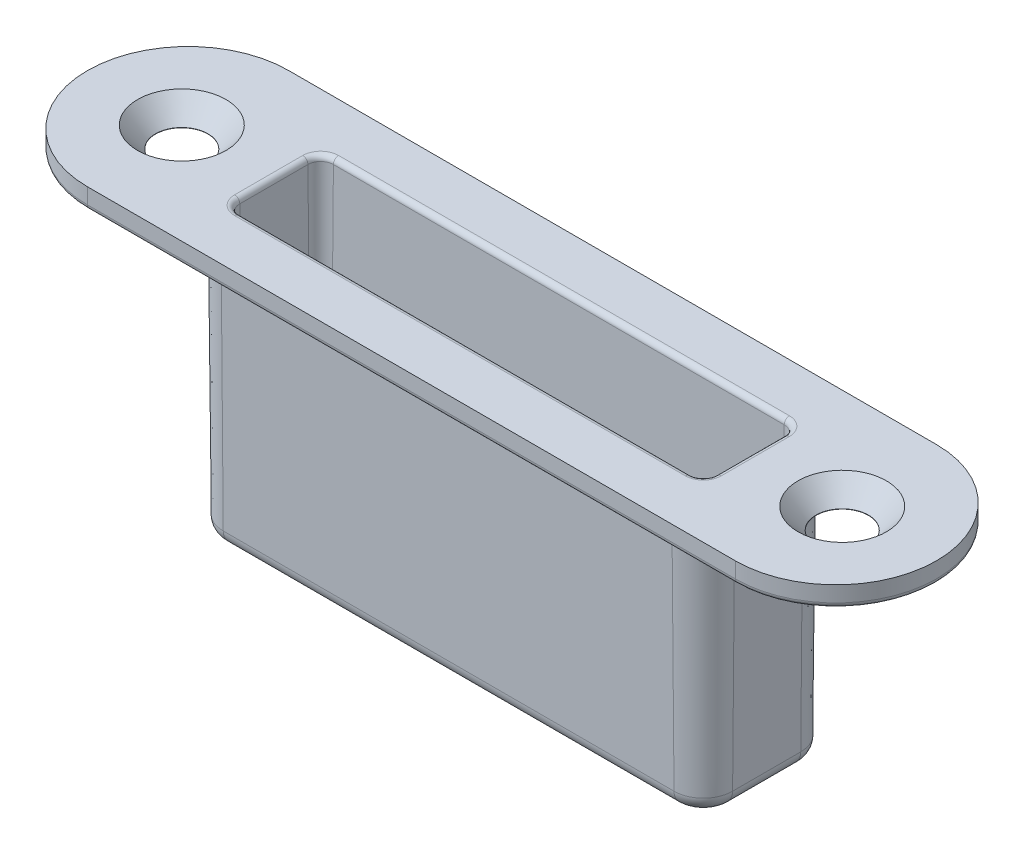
SolidWorks part; units mm, degrees
ref_plane "Front" through (0, 0, 0) normal (0, 0, 1) x (1, 0, 0)
ref_plane "Top" through (0, 0, 0) normal (0, 1, 0) x (1, 0, 0)
ref_plane "Right" through (0, 0, 0) normal (1, 0, 0) x (0, 0, -1)
sketch "Sketch1" plane through (0, 0, 0) normal (0, 1, 0) x (1, 0, 0)
  line L0 (-89.0227, 0) -> (77.7946, 0) construction
  line L1 (30.9, 9.6) -> (-30.9, 9.6)
  line L2 (-30.9, -9.6) -> (30.9, -9.6)
  line L3 (0, 45.3935) -> (0, -48.9224) construction
  line L4 (89.0227, 0) -> (-77.7946, 0) construction
  arc A0 (-30.9, 9.6) -> (-30.9, -9.6) centre (-30.9, 0) ccw
  arc A1 (30.9, 9.6) -> (30.9, -9.6) centre (30.9, 0) cw
  point P9 (0, 9.6)
  point P15 (0, -9.6)
  dimension "D1" = 9.6
  dimension "D2" = 61.8
extrude "Extrude1" add sketch "Sketch1" against normal blind 2
sketch "Sketch2" plane through (0, 0, 0) normal (0, 1, 0) x (-1, 0, 0)
  line L0 (-31.8747, 0) -> (31.774, 0) construction
  line L1 (18.25, 6.25) -> (-18.25, 6.25)
  line L2 (-18.25, -6.25) -> (18.25, -6.25)
  line L3 (0, -14.4297) -> (0, 13.9947) construction
  line L4 (24.5, 0) -> (24.5, -3.25)
  line L5 (21.5, -6.25) -> (18.25, -6.25)
  line L6 (24.5, 0) -> (24.5, 3.25)
  line L7 (21.5, 6.25) -> (18.25, 6.25)
  line L8 (-18.25, -6.25) -> (-21.5, -6.25)
  line L9 (-24.5, 0) -> (-24.5, -3.25)
  line L10 (-24.5, 0) -> (-24.5, 3.25)
  line L11 (-21.5, 6.25) -> (-18.25, 6.25)
  arc A0 (-18.25, 6.25) -> (-18.25, -6.25) centre (-18.25, 0) ccw construction
  arc A1 (18.25, 6.25) -> (18.25, -6.25) centre (18.25, 0) cw construction
  arc A2 (-21.5, -6.25) -> (-24.5, -3.25) centre (-21.5, -3.25) cw
  arc A3 (-24.5, 3.25) -> (-21.5, 6.25) centre (-21.5, 3.25) cw
  arc A4 (21.5, 6.25) -> (24.5, 3.25) centre (21.5, 3.25) cw
  arc A5 (24.5, -3.25) -> (21.5, -6.25) centre (21.5, -3.25) cw
  point P9 (0, 6.25)
  point P13 (0, -6.25)
  dimension "D2" = 49
  dimension "D3" = 3
  dimension "D1" = 12.5
extrude "Extrude2" add sketch "Sketch2" against normal blind 27
sketch "Sketch3" plane through (0, 0, 0) normal (0, 1, 0) x (1, 0, 0)
  line L0 (-40.5, 0) -> (29.1441, 0) construction
  line L1 (-22.5, 3.25) -> (-22.5, 0)
  line L2 (-22.5, 0) -> (-22.5, -3.25)
  line L3 (-21.5, -4.25) -> (-18.25, -4.25)
  line L4 (-18.25, -4.25) -> (18.25, -4.25)
  line L5 (18.25, -4.25) -> (21.5, -4.25)
  line L6 (22.5, -3.25) -> (22.5, 0)
  line L7 (22.5, 0) -> (22.5, 3.25)
  line L8 (21.5, 4.25) -> (18.25, 4.25)
  line L9 (18.25, 4.25) -> (-18.25, 4.25)
  line L10 (-18.25, 4.25) -> (-21.5, 4.25)
  line L11 (-24.5, 3.25) -> (-24.5, 0)
  line L12 (-24.5, 0) -> (-24.5, -3.25)
  line L13 (-21.5, -6.25) -> (-18.25, -6.25)
  line L14 (-18.25, -6.25) -> (18.25, -6.25)
  line L15 (18.25, -6.25) -> (21.5, -6.25)
  line L16 (24.5, -3.25) -> (24.5, 0)
  line L17 (24.5, 0) -> (24.5, 3.25)
  line L18 (21.5, 6.25) -> (18.25, 6.25)
  line L19 (18.25, 6.25) -> (-18.25, 6.25)
  line L20 (-18.25, 6.25) -> (-21.5, 6.25)
  line L21 (-24.5, 3.25) -> (-24.5, 0) construction
  line L22 (-24.5, 0) -> (-24.5, -3.25) construction
  line L23 (-21.5, -6.25) -> (-18.25, -6.25) construction
  line L24 (-18.25, -6.25) -> (18.25, -6.25) construction
  line L25 (18.25, -6.25) -> (21.5, -6.25) construction
  line L26 (24.5, -3.25) -> (24.5, 0) construction
  line L27 (24.5, 0) -> (24.5, 3.25) construction
  line L28 (21.5, 6.25) -> (18.25, 6.25) construction
  line L29 (18.25, 6.25) -> (-18.25, 6.25) construction
  line L30 (-18.25, 6.25) -> (-21.5, 6.25) construction
  arc A0 (-30.9, 9.6) -> (-30.9, -9.6) centre (-30.9, 0) ccw construction
  arc A1 (-22.5, -3.25) -> (-21.5, -4.25) centre (-21.5, -3.25) ccw
  arc A2 (21.5, -4.25) -> (22.5, -3.25) centre (21.5, -3.25) ccw
  arc A3 (22.5, 3.25) -> (21.5, 4.25) centre (21.5, 3.25) ccw
  arc A4 (-21.5, 4.25) -> (-22.5, 3.25) centre (-21.5, 3.25) ccw
  arc A5 (-24.5, -3.25) -> (-21.5, -6.25) centre (-21.5, -3.25) ccw
  arc A6 (21.5, -6.25) -> (24.5, -3.25) centre (21.5, -3.25) ccw
  arc A7 (24.5, 3.25) -> (21.5, 6.25) centre (21.5, 3.25) ccw
  arc A8 (-21.5, 6.25) -> (-24.5, 3.25) centre (-21.5, 3.25) ccw
  arc A9 (-24.5, -3.25) -> (-21.5, -6.25) centre (-21.5, -3.25) ccw construction
  arc A10 (21.5, -6.25) -> (24.5, -3.25) centre (21.5, -3.25) ccw construction
  arc A11 (24.5, 3.25) -> (21.5, 6.25) centre (21.5, 3.25) ccw construction
  arc A12 (-21.5, 6.25) -> (-24.5, 3.25) centre (-21.5, 3.25) ccw construction
  dimension "D1" = 0
  dimension "D2" = 2
extrude "Cut-Extrude1" cut sketch "Sketch3" against normal offset from surface (25 mm away) 2
sketch "Sketch4" plane through (0, 0, 0) normal (0, 1, 0) x (1, 0, 0)
  line L0 (-32.3348, 0) -> (32.4904, 0) construction
  line L1 (0, -1.9066) -> (0, 3.1518) construction
  circle A0 centre (-31.5, 0) radius 2.5
  circle A1 centre (31.5, 0) radius 2.5
  dimension "D2" = 5
  dimension "D1" = 63
extrude "Cut-Extrude2" cut sketch "Sketch4" against normal through all
hole_wizard "CSK for #8 Flat Head Machine Screw1" positions "Sketch6" profile "Sketch7" countersink size "#8" standard "ANSI Inch"
sketch "Sketch6" plane through (0, 0, 0) normal (0, 1, 0) x (1, 0, 0)
  point P0 (-31.5, 0)
  point P3 (31.5, 0)
sketch "Sketch7" plane through (-31.5, 0, 0) normal (1, 0, 0) x (0, 0, 1)
  line L0 (0, 0) -> (0, 27)
  line L1 (0, 27) -> (2.2479, 27)
  line L2 (2.2479, 27) -> (2.2479, 2.2645)
  line L3 (2.2479, 2.2645) -> (4.2164, 0)
  line L5 (4.2164, 0) -> (0, 0)
  line L6 (-2.2479, 2.2645) -> (-4.2164, 0) construction
  line L11 (0, -6.35) -> (0, 107.95) construction
  dimension "Thru Hole Dia." = 4.4958
  dimension "Thru Hole Depth" = 27
  dimension "Near C'Sink Dia." = 8.4328
  dimension "Near C'Sink Angle" = 82
sketch "Sketch9" plane through (0, -27, 0) normal (0, -1, 0) x (1, 0, 0)
  line L1 (-11.25, 2.5) -> (11.25, 2.5)
  line L2 (-11.25, 2.5) -> (-11.25, -2.5)
  line L3 (-11.25, -2.5) -> (11.25, -2.5)
  line L4 (11.25, 2.5) -> (11.25, -2.5)
  line L5 (-11.25, 2.5) -> (11.25, -2.5) construction
  line L6 (-11.25, -2.5) -> (11.25, 2.5) construction
  point P0 (0, 0)
  dimension "D1" = 5
  dimension "D2" = 22.5
extrude "Cut-Extrude5" cut sketch "Sketch9" against normal blind 0.5
sketch "Sketch8" plane through (0, -26.5, 0) normal (0, -1, 0) x (1, 0, 0)
  line L0 (-9.2062, 0) -> (9.2062, 0) construction
  line L1 (0, 0) -> (0, -5.3044) construction
  line L3 (9.2062, 1.7085) -> (9.2062, -1.5866) construction
sketch_block_instance "Block1-2"
sketch_block "Block1"
extrude "Boss-Extrude1" add sketch "Sketch8" along normal up to surface (0.5 mm away)
sketch "Sketch5" plane through (0, 0, 0) normal (0, 1, 0) x (1, 0, 0)
  line L0 (0, 9.6) -> (0, 15.711)
  line L1 (30.9, 9.6) -> (-30.9, 9.6) construction
  line L2 (0, 9.6) -> (0, -14.4821)
  line L3 (0, -14.4821) -> (40.5, -14.4821)
  line L4 (40.5, -14.4821) -> (40.5, 15.711)
  line L5 (40.5, 15.711) -> (0, 15.711)
  arc A0 (30.9, -9.6) -> (30.9, 9.6) centre (30.9, 0) ccw construction
extrude "Cut-Extrude3" [suppressed] cut sketch "Sketch5" against normal through all
draft "Draft1" type of draft neutral plane draft angle 0.5 faces to draft 8 parameters "D1"=0.5
draft "Draft2" type of draft neutral plane draft angle 0.5 faces to draft 8 parameters "D1"=0.5
draft "Draft5" type of draft neutral plane draft angle 0.5 faces to draft 4 parameters "D1"=0.5
fillet "Fillet1" radius 0.25 8 edges at (-24.5, -2, 0) (-23.6213, -2, -5.3713) (0, -2, -6.25) (23.6213, -2, -5.3713) (24.5, -2, 0) (23.6213, -2, 5.3713) (0, -2, 6.25) (-23.6213, -2, 5.3713)
fillet "Fillet3" radius 0.5 12 edges at (22.3614, 0, -4.1114) (22.7182, 0, 0) (22.3614, 0, 4.1114) (0, 0, 4.4682) (-22.3614, 0, 4.1114) (-22.7182, 0, 0) (-22.3614, 0, -4.1114) (0, 0, -4.4682) (0, -2, -9.5825) (40.4825, -2, 0) (0, -2, 9.5825) (-40.4825, -2, 0)
fillet "Fillet4" radius 1.5 8 edges at (-23.467, -27, 5.217) (-24.2818, -27, 0) (-23.467, -27, -5.217) (0, -27, -6.0318) (23.467, -27, -5.217) (24.2818, -27, 0) (23.467, -27, 5.217) (0, -27, 6.0318)
fillet "Fillet5" radius 1 8 edges at (22.2071, -25, -3.9571) (22.5, -25, 0) (22.2071, -25, 3.9571) (0, -25, 4.25) (-22.2071, -25, 3.9571) (-22.5, -25, 0) (-22.2071, -25, -3.9571) (0, -25, -4.25)
fillet "Fillet6" radius 1 4 edges at (11.25, -26.75, -2.5) (11.25, -26.75, 2.5) (-11.25, -26.75, -2.5) (-11.25, -26.75, 2.5)
